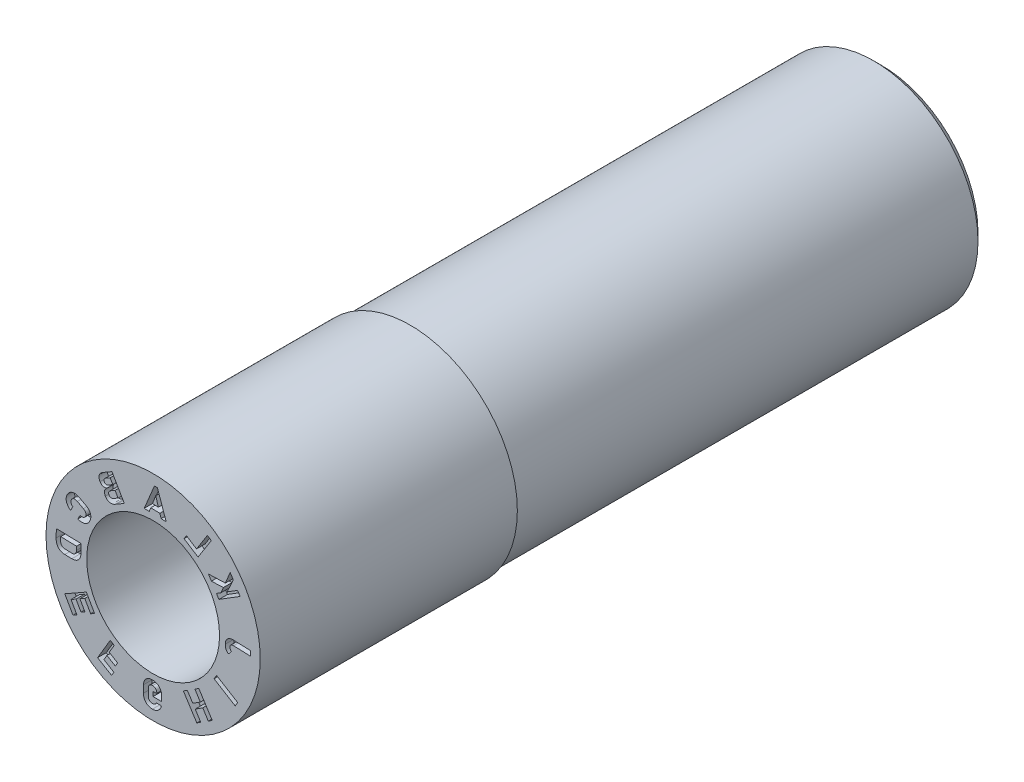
SolidWorks part; units mm, degrees
ref_plane "Front Plane" through (0, 0, 0) normal (0, 0, 1) x (1, 0, 0)
ref_plane "Top Plane" through (0, 0, 0) normal (0, 1, 0) x (1, 0, 0)
ref_plane "Right Plane" through (0, 0, 0) normal (1, 0, 0) x (0, 0, -1)
sketch "Sketch1" plane through (0, 0, 0) normal (1, 0, 0) x (0, 0, -1)
  line L2 (0, 2.5) -> (0, 1.55)
  line L3 (16.75, 2.5) -> (0, 2.5)
  line L4 (-3.7979, 0) -> (49996.2021, 0) construction
  line L8 (14, 0.8) -> (2.8, 0.8)
  line L9 (2.8, 1.55) -> (2.8, 0.8)
  line L10 (2.8, 1.55) -> (0, 1.55)
  line L12 (17, 1.5) -> (17, 2.25)
  line L16 (17, 2.25) -> (16.75, 2.5)
  line L17 (17, 1.5) -> (14, 1.5)
  line L18 (14, 0.8) -> (14, 1.5)
  dimension "D1" = 17
  dimension "D2" = 45
  dimension "D3" = 0.25
  dimension "D4" = 5
  dimension "D5" = 3.1
  dimension "D6" = 2.8
  dimension "D7" = 1.6
  dimension "D8" = 3
  dimension "D9" = 3
revolve "Revolve1" add sketch "Sketch1" angle 360 about L4
sketch "Sketch4" plane through (0, 0, 0) normal (1, 0, 0) x (0, 0, -1)
  line L0 (0, 0) -> (50000, 0) construction
  line L1 (17, -2.25) -> (17, 2.25) construction
  line L2 (6, 3.435) -> (17, 3.435)
  line L3 (6, 3.435) -> (6, 2.435)
  line L4 (6, 2.435) -> (17, 2.435)
  line L5 (17, 3.435) -> (17, 2.435)
  line L6 (16.75, 2.5) -> (0, 2.5) construction
  line L7 (0, 2.5) -> (0, -2.5) construction
  dimension "D1" = 1
  dimension "D2" = 0.065
  dimension "D3" = 6
revolve "Cut-Revolve1" cut sketch "Sketch4" angle 360 about L0
sketch "Sketch2" plane through (0, 0, 0) normal (0, 0, 1) x (1, 0, 0)
  line L0 (0, 0) -> (0, 2.6806) construction
  line L1 (0, 0) -> (1.3403, 2.3215) construction
  line L2 (0, 0) -> (2.3215, 1.3403) construction
  line L3 (0, 0) -> (2.6806, 0) construction
  line L4 (0, 0) -> (2.3215, -1.3403) construction
  line L5 (0, 0) -> (1.3403, -2.3215) construction
  line L6 (0, 0) -> (0, -2.6806) construction
  line L7 (0, 0) -> (-1.3403, -2.3215) construction
  line L8 (0, 0) -> (-2.3215, -1.3403) construction
  line L9 (0, 0) -> (-2.6806, 0) construction
  line L10 (0, 0) -> (-2.3215, 1.3403) construction
  line L11 (0, 0) -> (-1.3403, 2.3215) construction
  line L12 (1.7266, 0.971) -> (1.8709, 1.2837)
  line L13 (1.8709, 1.2837) -> (1.7982, 1.4007)
  line L14 (1.7982, 1.4007) -> (1.6855, 1.1276)
  line L15 (1.1583, -1.6578) -> (1.2877, -1.8604)
  line L16 (2.0288, 1.0298) -> (1.9709, 1.1228)
  line L17 (1.9709, 1.1228) -> (1.7266, 0.971)
  line L18 (1.4776, 0.8162) -> (1.5354, 0.7231)
  line L19 (1.5354, 0.7231) -> (2.0288, 1.0298)
  line L20 (1.6388, 1.0144) -> (1.5845, 0.8826)
  line L21 (1.6855, 1.1276) -> (1.2919, 1.1147)
  line L22 (1.2919, 1.1147) -> (1.3605, 1.0044)
  line L23 (1.3605, 1.0044) -> (1.6388, 1.0144)
  line L24 (1.3585, 1.8241) -> (1.2665, 1.8824)
  line L25 (1.2665, 1.8824) -> (1.0131, 1.4827)
  line L26 (1.5845, 0.8826) -> (1.4776, 0.8162)
  line L27 (1.0488, 1.3356) -> (1.3585, 1.8241)
  line L28 (1.0131, 1.4827) -> (0.7779, 1.6318)
  line L29 (0.7779, 1.6318) -> (0.7217, 1.543)
  line L30 (0.7217, 1.543) -> (1.0488, 1.3356)
  line L31 (0.9255, -1.6812) -> (0.7986, -1.4827)
  line L32 (0.1002, 2.2631) -> (0.0308, 2.2652)
  line L33 (0.0308, 2.2652) -> (-0.208, 1.6922)
  line L34 (-0.208, 1.6922) -> (-0.0903, 1.6888)
  line L35 (-0.0903, 1.6888) -> (-0.0551, 1.7806)
  line L36 (0.06, 2.0804) -> (0.1235, 1.8807)
  line L37 (0.1871, 1.6805) -> (0.3046, 1.6771)
  line L38 (0.3046, 1.6771) -> (0.1002, 2.2631)
  line L39 (0.1235, 1.8807) -> (-0.0151, 1.8847)
  line L40 (-0.0151, 1.8847) -> (0.06, 2.0804)
  line L41 (-0.0551, 1.7806) -> (0.1572, 1.7744)
  line L42 (0.1572, 1.7744) -> (0.1871, 1.6805)
  line L43 (-0.8186, 1.5946) -> (-0.9251, 1.5329)
  line L44 (-1.0272, 1.5531) -> (-1.0278, 1.5542)
  line L45 (-0.9947, 1.653) -> (-0.8882, 1.7147)
  line L46 (-2.2588, 0.2583) -> (-2.2634, 0.0666)
  line L47 (-0.9408, 1.8054) -> (-1.0472, 1.7438)
  line L48 (-1.1092, 1.8508) -> (-1.0028, 1.9124)
  line L49 (-1.1312, 1.9592) -> (-1.1649, 1.9397)
  line L50 (-0.8882, 1.7147) -> (-0.8186, 1.5946)
  line L51 (-1.1144, 1.4853) -> (-1.1138, 1.4841)
  line L52 (-0.8816, 1.4371) -> (-0.8427, 1.4596)
  line L54 (-0.9613, 2.0576) -> (-1.1312, 1.9592)
  line L55 (-1.0028, 1.9124) -> (-0.9408, 1.8054)
  line L56 (-0.8427, 1.4596) -> (-0.6722, 1.5584)
  line L57 (-0.6722, 1.5584) -> (-0.9613, 2.0576)
  line L58 (-1.5754, 1.0754) -> (-1.7153, 1.1506)
  line L59 (-1.9271, 0.7912) -> (-1.8735, 0.8908)
  line L60 (-1.7688, 1.051) -> (-1.6289, 0.9758)
  line L61 (-1.7052, 0.8003) -> (-1.7587, 0.7007)
  line L62 (-1.7872, 0.1375) -> (-1.7893, 0.0525)
  line L63 (-1.8913, -0.0578) -> (-2.0619, -0.0536)
  line L64 (-2.1583, 0.0615) -> (-2.1563, 0.1465)
  line L67 (-2.0614, -0.1669) -> (-1.8971, -0.1709)
  line L68 (-1.6839, 0.0528) -> (-1.6793, 0.2441)
  line L71 (-2.1563, 0.1465) -> (-1.7872, 0.1375)
  line L73 (-1.6793, 0.2441) -> (-2.2588, 0.2583)
  line L75 (-1.9162, -1.0044) -> (-1.7998, -0.9383)
  line L76 (-1.7082, -0.8863) -> (-1.5953, -0.8221)
  line L77 (-1.5577, -0.6752) -> (-2.0616, -0.9614)
  line L78 (-1.5953, -0.8221) -> (-1.4575, -1.0647)
  line L79 (-1.4575, -1.0647) -> (-1.366, -1.0127)
  line L80 (-1.366, -1.0127) -> (-1.5577, -0.6752)
  line L82 (-1.7998, -0.9383) -> (-1.6837, -1.1428)
  line L83 (-1.6837, -1.1428) -> (-1.5921, -1.0908)
  line L84 (-1.5921, -1.0908) -> (-1.7082, -0.8863)
  line L86 (-2.0616, -0.9614) -> (-1.8699, -1.2989)
  line L87 (-1.8699, -1.2989) -> (-1.7785, -1.2469)
  line L88 (-1.7785, -1.2469) -> (-1.9162, -1.0044)
  line L91 (-1.1487, -1.8361) -> (-1.0778, -1.7163)
  line L92 (-0.907, -1.4277) -> (-1.0011, -1.3721)
  line L93 (-1.0011, -1.3721) -> (-1.2963, -1.8711)
  line L94 (-1.0778, -1.7163) -> (-0.8818, -1.8322)
  line L95 (-0.8818, -1.8322) -> (-0.8281, -1.7417)
  line L96 (-0.8281, -1.7417) -> (-1.0242, -1.6258)
  line L97 (-1.0242, -1.6258) -> (-0.907, -1.4277)
  line L98 (-1.2963, -1.8711) -> (-0.9687, -2.065)
  line L99 (-0.9687, -2.065) -> (-0.915, -1.9743)
  line L100 (-0.915, -1.9743) -> (-1.1487, -1.8361)
  line L102 (0.1985, -2.0105) -> (0.1992, -1.8973)
  line L103 (-0.2247, -1.8818) -> (-0.2258, -2.0528)
  line L104 (0.1931, -2.0997) -> (0.0751, -2.099)
  line L105 (-0.1127, -2.0535) -> (-0.1116, -1.8825)
  line L106 (0.086, -1.895) -> (0.086, -1.9046)
  line L107 (0.086, -1.9046) -> (-0.0017, -1.904)
  line L108 (-0.0017, -1.904) -> (-0.0024, -2.0092)
  line L109 (-0.0024, -2.0092) -> (0.1985, -2.0105)
  line L110 (1.2877, -1.8604) -> (1.3802, -1.8013)
  line L111 (1.3802, -1.8013) -> (1.067, -1.3112)
  line L112 (1.067, -1.3112) -> (0.9746, -1.3702)
  line L113 (0.9746, -1.3702) -> (1.1014, -1.5688)
  line L114 (1.0194, -2.0318) -> (1.1118, -1.9728)
  line L115 (1.1118, -1.9728) -> (0.9823, -1.7702)
  line L116 (0.7986, -1.4827) -> (0.7063, -1.5416)
  line L117 (0.7063, -1.5416) -> (1.0194, -2.0318)
  line L118 (0.9823, -1.7702) -> (1.1583, -1.6578)
  line L120 (1.1014, -1.5688) -> (0.9255, -1.6812)
  line L122 (1.4806, -0.841) -> (1.4217, -0.9375)
  line L123 (1.4217, -0.9375) -> (1.9156, -1.2394)
  line L124 (1.9156, -1.2394) -> (1.9746, -1.143)
  line L125 (1.9746, -1.143) -> (1.4806, -0.841)
  line L126 (1.7577, -0.2694) -> (1.8259, -0.1826)
  line L127 (1.8774, -0.042) -> (2.2724, -0.0565)
  line L128 (2.2724, -0.0565) -> (2.2765, 0.0566)
  line L129 (2.2765, 0.0566) -> (1.8811, 0.0712)
  circle A54 centre (0, 0) radius 1.7058 construction
  spline S0 degree 3 poles (-0.9251, 1.5329) (-0.9347, 1.5274) (-0.9495, 1.5207) (-0.9701, 1.5179) (-0.984, 1.5191) (-0.9971, 1.5232) (-1.0132, 1.5331) (-1.0224, 1.5446) (-1.0272, 1.5531) knots 0 0 0 0 0.283177 0.406051 0.522898 0.636531 0.750638 1 1 1 1
  spline S1 degree 3 poles (-1.0278, 1.5542) (-1.0311, 1.5601) (-1.0355, 1.5691) (-1.0382, 1.5818) (-1.0388, 1.5909) (-1.0379, 1.5998) (-1.0359, 1.6086) (-1.0321, 1.6169) (-1.0272, 1.625) (-1.0209, 1.6327) (-1.0106, 1.6429) (-1.0012, 1.649) (-0.9947, 1.653) knots 0 0 0 0 0.172443 0.251642 0.328086 0.402715 0.47761 0.553924 0.633837 0.717732 0.805932 1 1 1 1
  spline S2 degree 3 poles (-1.0472, 1.7438) (-1.0559, 1.7387) (-1.0694, 1.7328) (-1.0881, 1.7305) (-1.1009, 1.7318) (-1.1128, 1.7361) (-1.128, 1.7454) (-1.1361, 1.7567) (-1.1409, 1.7646) knots 0 0 0 0 0.277909 0.398836 0.514793 0.628277 0.744294 1 1 1 1
  spline S3 degree 3 poles (-1.1409, 1.7646) (-1.1451, 1.7718) (-1.1499, 1.7836) (-1.1497, 1.8) (-1.147, 1.8115) (-1.1413, 1.8226) (-1.13, 1.8373) (-1.1178, 1.8455) (-1.1092, 1.8508) knots 0 0 0 0 0.243539 0.354356 0.466789 0.583916 0.708822 1 1 1 1
  spline S4 degree 3 poles (-1.1649, 1.9397) (-1.18, 1.9311) (-1.2008, 1.9165) (-1.2244, 1.8938) (-1.2384, 1.8763) (-1.2496, 1.858) (-1.2577, 1.839) (-1.2625, 1.8193) (-1.2641, 1.799) (-1.2628, 1.7784) (-1.2563, 1.7498) (-1.2471, 1.7291) (-1.2394, 1.7159) knots 0 0 0 0 0.194841 0.282947 0.366427 0.445852 0.522292 0.597128 0.672122 0.748837 0.828157 1 1 1 1
  spline S5 degree 3 poles (-1.2394, 1.7159) (-1.2339, 1.7067) (-1.225, 1.6937) (-1.2099, 1.6795) (-1.1982, 1.6706) (-1.1854, 1.6637) (-1.172, 1.6582) (-1.1577, 1.6548) (-1.1428, 1.6531) (-1.1274, 1.6531) (-1.1056, 1.6558) (-1.0894, 1.6604) (-1.0787, 1.6644) knots 0 0 0 0 0.172529 0.253083 0.332554 0.410188 0.487931 0.566064 0.646434 0.729378 0.814892 1 1 1 1
  spline S6 degree 3 poles (-1.0787, 1.6644) (-1.0883, 1.6569) (-1.1014, 1.6448) (-1.1156, 1.6262) (-1.1237, 1.6118) (-1.1302, 1.597) (-1.1342, 1.5817) (-1.1364, 1.566) (-1.1361, 1.5501) (-1.1339, 1.5339) (-1.1279, 1.5116) (-1.1204, 1.4956) (-1.1144, 1.4853) knots 0 0 0 0 0.18028 0.26392 0.345728 0.425166 0.503121 0.580165 0.658737 0.739149 0.822201 1 1 1 1
  spline S7 degree 3 poles (-1.1138, 1.4841) (-1.106, 1.4708) (-1.0928, 1.4522) (-1.0708, 1.4324) (-1.0535, 1.4208) (-1.035, 1.4121) (-1.0154, 1.4066) (-0.9948, 1.4039) (-0.9732, 1.4046) (-0.951, 1.4081) (-0.9195, 1.4173) (-0.8966, 1.4284) (-0.8816, 1.4371) knots 0 0 0 0 0.172357 0.251846 0.328866 0.404201 0.478853 0.555423 0.635018 0.718404 0.805968 1 1 1 1
  spline S8 degree 3 poles (-1.4845, 0.7886) (-1.4794, 0.7979) (-1.4727, 0.8121) (-1.4653, 0.8314) (-1.4609, 0.8455) (-1.4574, 0.8594) (-1.4551, 0.8732) (-1.4535, 0.8868) (-1.4531, 0.9002) (-1.4536, 0.9135) (-1.4551, 0.9264) (-1.4574, 0.9391) (-1.4608, 0.9515) (-1.4652, 0.9637) (-1.4704, 0.9756) (-1.4769, 0.9871) (-1.484, 0.9985) (-1.4923, 1.0095) (-1.5015, 1.0201) (-1.5115, 1.0303) (-1.5224, 1.0402) (-1.5343, 1.0496) (-1.5517, 1.0619) (-1.5656, 1.0702) (-1.5754, 1.0754) knots 0 0 0 0 0.093276 0.137538 0.180723 0.222499 0.263281 0.303237 0.342603 0.381322 0.4193 0.456742 0.494513 0.532189 0.569985 0.608428 0.647787 0.687904 0.728623 0.770463 0.813247 0.857568 0.903468 1 1 1 1
  spline S9 degree 3 poles (-1.7153, 1.1506) (-1.7249, 1.1559) (-1.7396, 1.1629) (-1.7595, 1.1705) (-1.7739, 1.1754) (-1.7882, 1.179) (-1.8022, 1.1818) (-1.8161, 1.1837) (-1.8298, 1.1844) (-1.8433, 1.1842) (-1.8564, 1.183) (-1.8693, 1.181) (-1.8818, 1.1779) (-1.8941, 1.174) (-1.906, 1.1691) (-1.9176, 1.163) (-1.929, 1.1563) (-1.94, 1.1484) (-1.9506, 1.1398) (-1.9606, 1.1301) (-1.9704, 1.1195) (-1.9797, 1.1081) (-1.9917, 1.0913) (-1.9997, 1.0778) (-2.0048, 1.0685) knots 0 0 0 0 0.096625 0.142399 0.186863 0.229624 0.271353 0.312454 0.352417 0.39167 0.430119 0.467963 0.505732 0.542992 0.580961 0.618805 0.657495 0.696861 0.736763 0.777446 0.81938 0.862387 0.906737 1 1 1 1
  spline S10 degree 3 poles (-2.0048, 1.0685) (-2.0131, 1.0533) (-2.0229, 1.0294) (-2.0294, 0.9962) (-2.0309, 0.9717) (-2.0291, 0.9472) (-2.0242, 0.923) (-2.0156, 0.8994) (-2.0041, 0.8761) (-1.9894, 0.8535) (-1.9651, 0.8235) (-1.9429, 0.8037) (-1.9271, 0.7912) knots 0 0 0 0 0.164202 0.242597 0.31964 0.396683 0.474246 0.5531 0.634724 0.719833 0.808343 1 1 1 1
  spline S11 degree 3 poles (-1.8735, 0.8908) (-1.8806, 0.8968) (-1.8903, 0.9064) (-1.901, 0.9205) (-1.9074, 0.9311) (-1.9125, 0.9418) (-1.9163, 0.9526) (-1.9187, 0.9635) (-1.9196, 0.9744) (-1.9193, 0.9852) (-1.9166, 0.9998) (-1.9125, 1.0102) (-1.9089, 1.0168) knots 0 0 0 0 0.194934 0.28555 0.372724 0.455674 0.535358 0.613625 0.690099 0.765614 0.84131 1 1 1 1
  spline S12 degree 3 poles (-1.9089, 1.0168) (-1.9044, 1.0253) (-1.8966, 1.0369) (-1.8836, 1.0496) (-1.8734, 1.0572) (-1.8622, 1.0628) (-1.8504, 1.0666) (-1.838, 1.0686) (-1.8249, 1.0689) (-1.8113, 1.0671) (-1.7921, 1.0621) (-1.778, 1.0561) (-1.7688, 1.051) knots 0 0 0 0 0.17457 0.254565 0.331757 0.407201 0.482036 0.557841 0.637209 0.720532 0.807255 1 1 1 1
  spline S13 degree 3 poles (-1.6289, 0.9758) (-1.6197, 0.9707) (-1.6067, 0.9625) (-1.592, 0.9492) (-1.5833, 0.9388) (-1.5763, 0.9279) (-1.5711, 0.9164) (-1.568, 0.9045) (-1.5667, 0.8922) (-1.5671, 0.8795) (-1.5708, 0.8617) (-1.5759, 0.8486) (-1.5806, 0.8403) knots 0 0 0 0 0.193512 0.28063 0.362837 0.441628 0.51779 0.592525 0.667191 0.744401 0.824637 1 1 1 1
  spline S14 degree 3 poles (-1.5806, 0.8403) (-1.5843, 0.8336) (-1.5906, 0.8242) (-1.6013, 0.8138) (-1.6101, 0.8073) (-1.6197, 0.8021) (-1.63, 0.7977) (-1.6411, 0.7951) (-1.6529, 0.7934) (-1.6652, 0.7931) (-1.6829, 0.7945) (-1.6963, 0.7975) (-1.7052, 0.8003) knots 0 0 0 0 0.160101 0.235763 0.311874 0.388094 0.465534 0.54522 0.627617 0.714045 0.804103 1 1 1 1
  spline S15 degree 3 poles (-1.7587, 0.7007) (-1.7395, 0.6944) (-1.7107, 0.687) (-1.6723, 0.6833) (-1.6453, 0.6836) (-1.6196, 0.6867) (-1.5953, 0.6927) (-1.5723, 0.7017) (-1.551, 0.7137) (-1.5314, 0.7284) (-1.5071, 0.7519) (-1.4928, 0.7734) (-1.4845, 0.7886) knots 0 0 0 0 0.192088 0.280832 0.365704 0.447404 0.525862 0.603384 0.680175 0.757266 0.835593 1 1 1 1
  spline S16 degree 3 poles (-1.7893, 0.0525) (-1.7895, 0.044) (-1.7907, 0.0317) (-1.7936, 0.0158) (-1.7967, 0.0051) (-1.8006, -0.0049) (-1.8054, -0.0141) (-1.8109, -0.0225) (-1.8172, -0.0302) (-1.8241, -0.037) (-1.8318, -0.0428) (-1.8401, -0.0477) (-1.8491, -0.0517) (-1.8588, -0.0546) (-1.8728, -0.0576) (-1.8838, -0.058) (-1.8913, -0.0578) knots 0 0 0 0 0.148983 0.217482 0.282936 0.345735 0.405807 0.46443 0.522277 0.579067 0.635059 0.691481 0.748728 0.807608 0.868362 1 1 1 1
  spline S17 degree 3 poles (-2.0619, -0.0536) (-2.0694, -0.0536) (-2.0804, -0.0523) (-2.0944, -0.049) (-2.1038, -0.0454) (-2.1126, -0.0411) (-2.1207, -0.0358) (-2.128, -0.0295) (-2.1347, -0.0224) (-2.1406, -0.0145) (-2.1456, -0.0058) (-2.1499, 0.0036) (-2.1531, 0.0139) (-2.1559, 0.0247) (-2.158, 0.0407) (-2.1586, 0.053) (-2.1583, 0.0615) knots 0 0 0 0 0.131833 0.193163 0.25202 0.308711 0.364837 0.421574 0.478332 0.535824 0.594355 0.655003 0.717193 0.782203 0.851268 1 1 1 1
  spline S18 degree 3 poles (-2.2634, 0.0666) (-2.2636, 0.055) (-2.2636, 0.0377) (-2.2613, 0.0153) (-2.2592, -0.0006) (-2.2562, -0.0159) (-2.2522, -0.0304) (-2.2478, -0.0444) (-2.2424, -0.0577) (-2.2363, -0.0703) (-2.2293, -0.0821) (-2.2219, -0.0933) (-2.2136, -0.1037) (-2.2046, -0.1133) (-2.1948, -0.1221) (-2.1844, -0.1303) (-2.1732, -0.1375) (-2.1615, -0.1441) (-2.149, -0.1499) (-2.1358, -0.1547) (-2.1222, -0.159) (-2.1078, -0.1621) (-2.0876, -0.1655) (-2.072, -0.1667) (-2.0614, -0.1669) knots 0 0 0 0 0.099794 0.147021 0.192532 0.236902 0.279656 0.321378 0.362154 0.402037 0.440934 0.479138 0.516785 0.554126 0.59163 0.629044 0.66688 0.705532 0.744313 0.784197 0.824816 0.866448 0.909455 1 1 1 1
  spline S19 degree 3 poles (-1.8971, -0.1709) (-1.887, -0.171) (-1.8721, -0.1708) (-1.8525, -0.1685) (-1.8385, -0.1662) (-1.825, -0.1628) (-1.812, -0.1587) (-1.7995, -0.1537) (-1.7874, -0.148) (-1.7759, -0.1415) (-1.765, -0.1341) (-1.7547, -0.1259) (-1.745, -0.1169) (-1.736, -0.1071) (-1.7277, -0.0963) (-1.7199, -0.0848) (-1.7128, -0.0725) (-1.7063, -0.0594) (-1.7007, -0.0456) (-1.696, -0.031) (-1.6919, -0.0157) (-1.6887, 0.0004) (-1.6853, 0.0232) (-1.6844, 0.0408) (-1.6839, 0.0528) knots 0 0 0 0 0.086499 0.1278 0.168162 0.207901 0.246686 0.285119 0.322936 0.360774 0.398289 0.435513 0.47314 0.51117 0.549849 0.589296 0.629811 0.671289 0.713786 0.75741 0.802522 0.849197 0.897584 1 1 1 1
  spline S20 degree 3 poles (0.1992, -1.8973) (0.1993, -1.8868) (0.1987, -1.8713) (0.1961, -1.8511) (0.1933, -1.8366) (0.1898, -1.8226) (0.1853, -1.8091) (0.1802, -1.7959) (0.1741, -1.7834) (0.1673, -1.7714) (0.1599, -1.76) (0.1516, -1.7494) (0.1428, -1.7394) (0.1332, -1.7302) (0.1231, -1.7215) (0.1122, -1.7137) (0.1006, -1.7066) (0.0884, -1.7001) (0.0757, -1.6947) (0.0626, -1.6898) (0.0489, -1.6861) (0.0348, -1.683) (0.0151, -1.6801) (0, -1.6791) (-0.0102, -1.679) knots 0 0 0 0 0.091997 0.136096 0.179244 0.221605 0.263351 0.304529 0.34559 0.386118 0.425805 0.465252 0.504244 0.542966 0.582093 0.621405 0.661336 0.701779 0.741997 0.783087 0.824689 0.86675 0.910115 1 1 1 1
  spline S21 degree 3 poles (-0.0102, -1.679) (-0.0205, -1.6789) (-0.0357, -1.6795) (-0.0555, -1.6822) (-0.0698, -1.6847) (-0.0835, -1.6885) (-0.0969, -1.6925) (-0.1097, -1.6978) (-0.1221, -1.7036) (-0.1338, -1.7102) (-0.1451, -1.7173) (-0.1555, -1.7253) (-0.1653, -1.7339) (-0.1744, -1.7431) (-0.1829, -1.753) (-0.1907, -1.7635) (-0.1976, -1.7748) (-0.204, -1.7865) (-0.2095, -1.7987) (-0.2141, -1.8114) (-0.218, -1.8246) (-0.2208, -1.8383) (-0.2239, -1.8573) (-0.2245, -1.872) (-0.2247, -1.8818) knots 0 0 0 0 0.092559 0.137075 0.180551 0.223302 0.265207 0.306774 0.347925 0.38851 0.428516 0.467745 0.506986 0.545932 0.584778 0.624219 0.664067 0.70411 0.744369 0.785043 0.82633 0.867995 0.911053 1 1 1 1
  spline S22 degree 3 poles (-0.2258, -2.0528) (-0.2259, -2.0633) (-0.2253, -2.0788) (-0.2227, -2.099) (-0.2199, -2.1135) (-0.2163, -2.1275) (-0.2119, -2.141) (-0.2068, -2.1541) (-0.2007, -2.1666) (-0.1938, -2.1785) (-0.1865, -2.1899) (-0.1781, -2.2004) (-0.1693, -2.2104) (-0.1599, -2.2197) (-0.1495, -2.2281) (-0.1386, -2.236) (-0.127, -2.2431) (-0.115, -2.2496) (-0.1022, -2.255) (-0.0892, -2.2599) (-0.0755, -2.2636) (-0.0615, -2.2667) (-0.0418, -2.2697) (-0.0267, -2.2706) (-0.0165, -2.2707) knots 0 0 0 0 0.092104 0.136598 0.179796 0.222206 0.264 0.304905 0.346014 0.386289 0.426023 0.465245 0.504282 0.543048 0.58227 0.621628 0.661605 0.701785 0.74237 0.783181 0.824831 0.86694 0.910012 1 1 1 1
  spline S23 degree 3 poles (-0.0165, -2.2707) (0.0003, -2.2707) (0.0252, -2.2685) (0.057, -2.2596) (0.0795, -2.2504) (0.1006, -2.2388) (0.12, -2.2248) (0.1376, -2.2086) (0.1533, -2.1902) (0.167, -2.17) (0.182, -2.1403) (0.1898, -2.1163) (0.1931, -2.0997) knots 0 0 0 0 0.17074 0.253562 0.335949 0.417756 0.498685 0.579331 0.661413 0.744362 0.827662 1 1 1 1
  spline S24 degree 3 poles (0.0751, -2.099) (0.0731, -2.1049) (0.0691, -2.1135) (0.0618, -2.1237) (0.0555, -2.1308) (0.0481, -2.1368) (0.0404, -2.1424) (0.0319, -2.147) (0.0139, -2.1546) (-0.0026, -2.1573) (-0.0157, -2.1574) knots 0 0 0 0 0.163474 0.244456 0.326462 0.409238 0.491403 0.57488 0.658814 1 1 1 1
  spline S25 degree 3 poles (-0.0157, -2.1574) (-0.0249, -2.1574) (-0.0384, -2.1558) (-0.0553, -2.1502) (-0.0669, -2.1446) (-0.0773, -2.1375) (-0.0866, -2.1289) (-0.0946, -2.119) (-0.1012, -2.1078) (-0.1065, -2.0956) (-0.1115, -2.0775) (-0.1128, -2.0632) (-0.1127, -2.0535) knots 0 0 0 0 0.172581 0.253084 0.33296 0.411744 0.490113 0.56871 0.64919 0.732419 0.81786 1 1 1 1
  spline S26 degree 3 poles (-0.1116, -1.8825) (-0.1113, -1.874) (-0.1103, -1.8612) (-0.1046, -1.8455) (-0.0991, -1.8347) (-0.0923, -1.8249) (-0.0839, -1.8164) (-0.0744, -1.809) (-0.0636, -1.8029) (-0.0518, -1.7981) (-0.0344, -1.7932) (-0.0204, -1.7924) (-0.011, -1.7923) knots 0 0 0 0 0.169045 0.249343 0.328175 0.406361 0.484363 0.562826 0.643932 0.72744 0.813945 1 1 1 1
  spline S27 degree 3 poles (-0.011, -1.7923) (-0.0017, -1.7923) (0.0119, -1.794) (0.0292, -1.7991) (0.0407, -1.8046) (0.0512, -1.8113) (0.0603, -1.8197) (0.0683, -1.8292) (0.0747, -1.8403) (0.0799, -1.8525) (0.0848, -1.8707) (0.0861, -1.8852) (0.086, -1.895) knots 0 0 0 0 0.174905 0.256505 0.336183 0.413876 0.489778 0.567355 0.646933 0.729306 0.81466 1 1 1 1
  spline S28 degree 3 poles (1.6842, -0.1067) (1.6835, -0.1236) (1.685, -0.1487) (1.6925, -0.1806) (1.7009, -0.2024) (1.7115, -0.2226) (1.7289, -0.2467) (1.7455, -0.2614) (1.7577, -0.2694) knots 0 0 0 0 0.271888 0.400105 0.525169 0.647125 0.765607 1 1 1 1
  spline S29 degree 3 poles (1.8259, -0.1826) (1.8202, -0.1777) (1.8122, -0.1696) (1.8039, -0.1571) (1.7987, -0.1472) (1.7948, -0.1368) (1.791, -0.1227) (1.7903, -0.1118) (1.7905, -0.1046) knots 0 0 0 0 0.25599 0.381214 0.507993 0.63311 0.755677 1 1 1 1
  spline S30 degree 3 poles (1.7905, -0.1046) (1.791, -0.0952) (1.7935, -0.0809) (1.804, -0.0655) (1.8142, -0.0562) (1.827, -0.0492) (1.848, -0.0425) (1.8654, -0.0415) (1.8774, -0.042) knots 0 0 0 0 0.235863 0.344479 0.456802 0.574861 0.702389 1 1 1 1
  spline S31 degree 3 poles (1.8811, 0.0712) (1.8625, 0.0718) (1.835, 0.0707) (1.8005, 0.0625) (1.7811, 0.0553) (1.7669, 0.0481) (1.7569, 0.0421) (1.7476, 0.0354) (1.7388, 0.0282) (1.7306, 0.0203) (1.7231, 0.0117) (1.7162, 0.0024) (1.7099, -0.0074) (1.7043, -0.0179) (1.6994, -0.029) (1.6951, -0.0405) (1.6916, -0.0527) (1.6886, -0.0654) (1.6857, -0.0834) (1.6845, -0.0973) (1.6842, -0.1067) knots 0 0 0 0 0.185794 0.270783 0.35146 0.390773 0.429197 0.466961 0.504582 0.542265 0.579973 0.617955 0.656636 0.696035 0.735873 0.776978 0.81856 0.861713 0.906477 1 1 1 1
  point P17 (0, 0)
  dimension "D1" = 12
extrude "Cut-Extrude1" cut sketch "Sketch2" against normal blind 0.2
sketch "Sketch3" plane through (0, 0, -2.8) normal (0, 0, 1) x (1, 0, 0)
  line L0 (0, 0) -> (0, 50000) construction
  line L1 (0.4619, 0.8) -> (-0.4619, 0.8)
  line L2 (-0.4619, 0.8) -> (-0.9238, 0)
  line L3 (-0.9238, 0) -> (-0.4619, -0.8)
  line L4 (-0.4619, -0.8) -> (0.4619, -0.8)
  line L5 (0.4619, -0.8) -> (0.9238, 0)
  line L6 (0.9238, 0) -> (0.4619, 0.8)
  line L7 (0, 0) -> (50000, 0) construction
  circle A0 centre (0, 0) radius 0.8 construction
  circle A1 centre (0, 0) radius 0.8 construction
extrude "Cut-Extrude2" cut sketch "Sketch3" against normal blind 1.4
